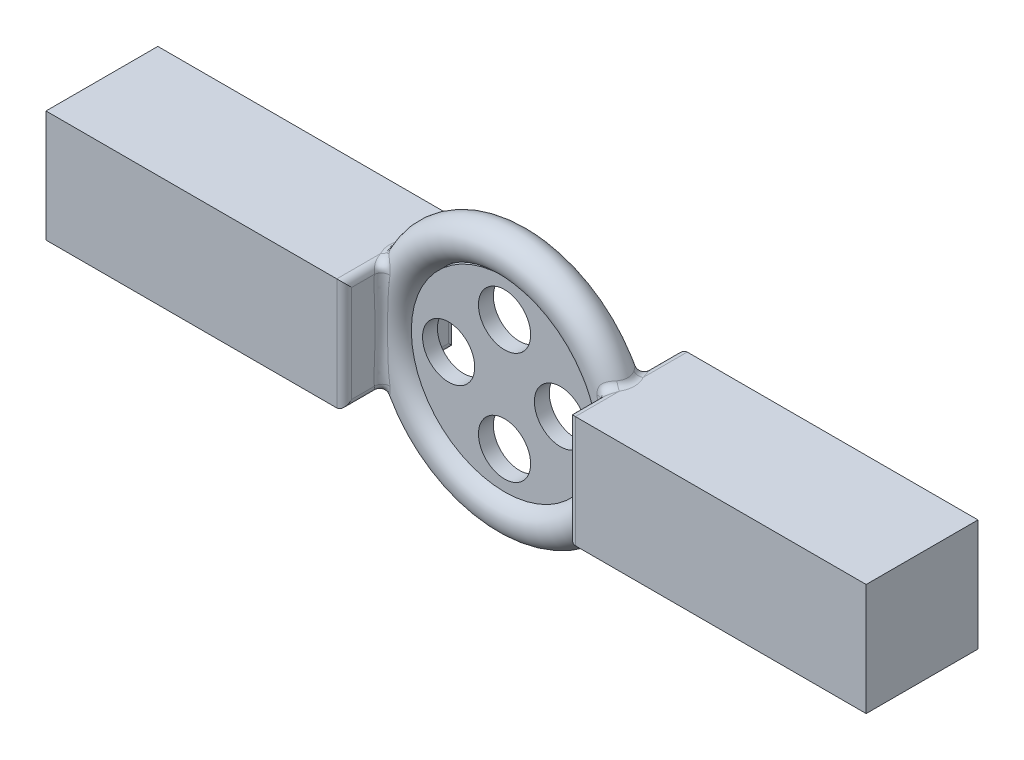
SolidWorks part; units mm, degrees
ref_plane "Front Plane" through (0, 0, 0) normal (0, 0, 1) x (1, 0, 0)
ref_plane "Top Plane" through (0, 0, 0) normal (0, 1, 0) x (1, 0, 0)
ref_plane "Right Plane" through (0, 0, 0) normal (1, 0, 0) x (0, 0, -1)
sketch "Sketch1" plane through (0, 0, 0) normal (0, 1, 0) x (1, 0, 0)
  line L0 (0, -210.8616) -> (0, 210.8616) construction
  circle A0 centre (-150, 0) radius 25
  point P4 (0, 0)
  dimension "D1" = 150
  dimension "D2" = 50
revolve "Revolve1" add sketch "Sketch1" angle 360 about L0
ref_plane "Plane1" through (150, 0, 0) normal (1, 0, 0) x (0, 0, -1)
sketch "Sketch4" plane through (150, 0, 0) normal (1, 0, 0) x (0, 0, -1)
  line L1 (-75, -75) -> (75, -75)
  line L2 (-75, -75) -> (-75, 75)
  line L3 (-75, 75) -> (75, 75)
  line L4 (75, -75) -> (75, 75)
  line L5 (-75, -75) -> (75, 75) construction
  line L6 (-75, 75) -> (75, -75) construction
  point P0 (0, 0)
  dimension "D1" = 150
  dimension "D2" = 150
extrude "Boss-Extrude2" add sketch "Sketch4" along normal blind 400
ref_plane "Plane2" through (-150, 0, 0) normal (1, 0, 0) x (0, 0, -1)
sketch "Sketch5" plane through (-150, 0, 0) normal (1, 0, 0) x (0, 0, -1)
  line L1 (75, -75) -> (-75, -75)
  line L2 (75, -75) -> (75, 75)
  line L3 (75, 75) -> (-75, 75)
  line L4 (-75, -75) -> (-75, 75)
  line L5 (75, -75) -> (-75, 75) construction
  line L6 (75, 75) -> (-75, -75) construction
  point P0 (0, 0)
extrude "Boss-Extrude3" add sketch "Sketch5" against normal blind 400
fillet "Fillet1" radius 10 20 edges at (157.7876, -75, 3.8276) (100.1228, 75, -2.2145) (-100.0233, -75, -0.9658) (-100.1228, 75, -2.2145) (150, 75, 46.3251) (150, 0, 75) (150, -75, 46.3251) (150, 44.4653, 24.1531) (150, -45.2103, -24.0951) (150, -75, -46.3251) (150, 0, -75) (150, 75, -46.3251) (-150, 75, -46.3251) (-150, 0, -75) (-150, -75, -46.3251) (-150, 44.4653, -24.1531) (-150, -45.2103, 24.0951) (-150, -75, 46.3251) (-150, 0, 75) (-150, 75, 46.3251)
sketch "Sketch6" plane through (0, 0, 0) normal (0, 0, 1) x (1, 0, 0)
  circle A0 centre (0, 0) radius 125
extrude "Boss-Extrude4" add sketch "Sketch6" along normal mid plane 20 separate body
sketch "Sketch7" plane through (0, 0, 10) normal (0, 0, 1) x (1, 0, 0)
  circle A0 centre (0, 0) radius 75
  circle A1 centre (0, 75) radius 35
  circle A2 centre (75, 0) radius 35
  circle A3 centre (0, -75) radius 35
  circle A4 centre (-75, 0) radius 35
  dimension "D1" = 4
extrude "Cut-Extrude1" cut sketch "Sketch7" against normal through all contours A1 | A4 | A3 | A2
